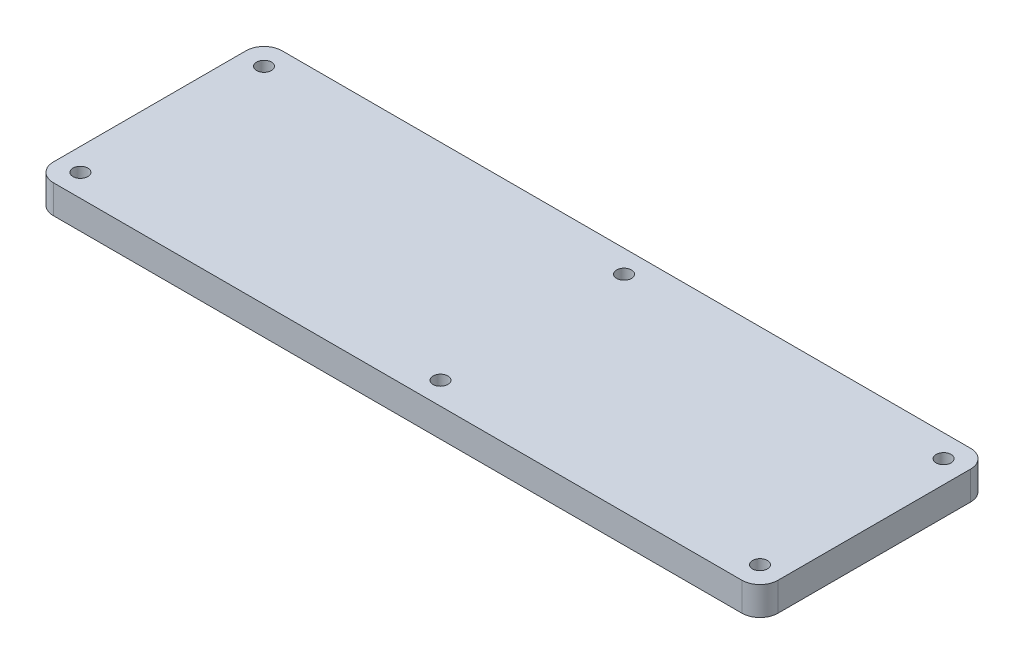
SolidWorks part; units mm, degrees
ref_plane "Front Plane" through (0, 0, 0) normal (0, 0, 1) x (1, 0, 0)
ref_plane "Top Plane" through (0, 0, 0) normal (0, 1, 0) x (1, 0, 0)
ref_plane "Right Plane" through (0, 0, 0) normal (1, 0, 0) x (0, 0, -1)
sketch "Sketch1" plane through (0, 0, 0) normal (0, 1, 0) x (1, 0, 0)
  line L1 (-46.4116, -25.1858) -> (114.5884, -25.1858)
  line L2 (-46.4116, -25.1858) -> (-46.4116, 25.6142)
  line L3 (-46.4116, 25.6142) -> (114.5884, 25.6142)
  line L4 (114.5884, -25.1858) -> (114.5884, 25.6142)
  dimension "D1" = 50.8
  dimension "D2" = 161
extrude "Boss-Extrude1" add sketch "Sketch1" along normal blind 6.35
fillet "Fillet1" radius 4 4 edges at (114.5884, 3.175, 25.1858) (114.5884, 3.175, -25.6142) (-46.4116, 3.175, 25.1858) (-46.4116, 3.175, -25.6142)
hole_wizard "M4x0.7 Tapped Hole1" positions "Sketch3" profile "Sketch2" tap size "M4x0.7" standard "ANSI Metric"
sketch "Sketch3" plane through (0, 6.35, 0) normal (0, 1, 0) x (1, 0, 0)
  line L0 (-42.4116, -25.1858) -> (110.5884, -25.1858) construction
  line L1 (-46.4116, 21.6142) -> (-46.4116, -21.1858) construction
  point P0 (-41.4116, -20.1858)
  point P2 (38.5884, -20.1858)
  point P4 (109.5884, -20.1858)
  point P6 (109.5884, 20.6142)
  point P8 (38.5884, 20.6142)
  point P10 (-41.4116, 20.6142)
  dimension "D1" = 5
  dimension "D2" = 5
  dimension "D3" = 85
  dimension "D4" = 156
  dimension "D5" = 45.8
sketch "Sketch2" plane through (-41.4116, 6.35, 20.1858) normal (1, 0, 0) x (0, 0, 1)
  line L0 (0, 0) -> (0, 6.35)
  line L1 (0, 6.35) -> (1.65, 6.35)
  line L2 (1.65, 6.35) -> (1.65, 0)
  line L5 (1.65, 0) -> (0, 0)
  line L11 (0, -6.35) -> (0, 107.95) construction
  dimension "Thru Tap Drill Dia." = 3.3
  dimension "Thru Tap Drill Depth" = 6.35
